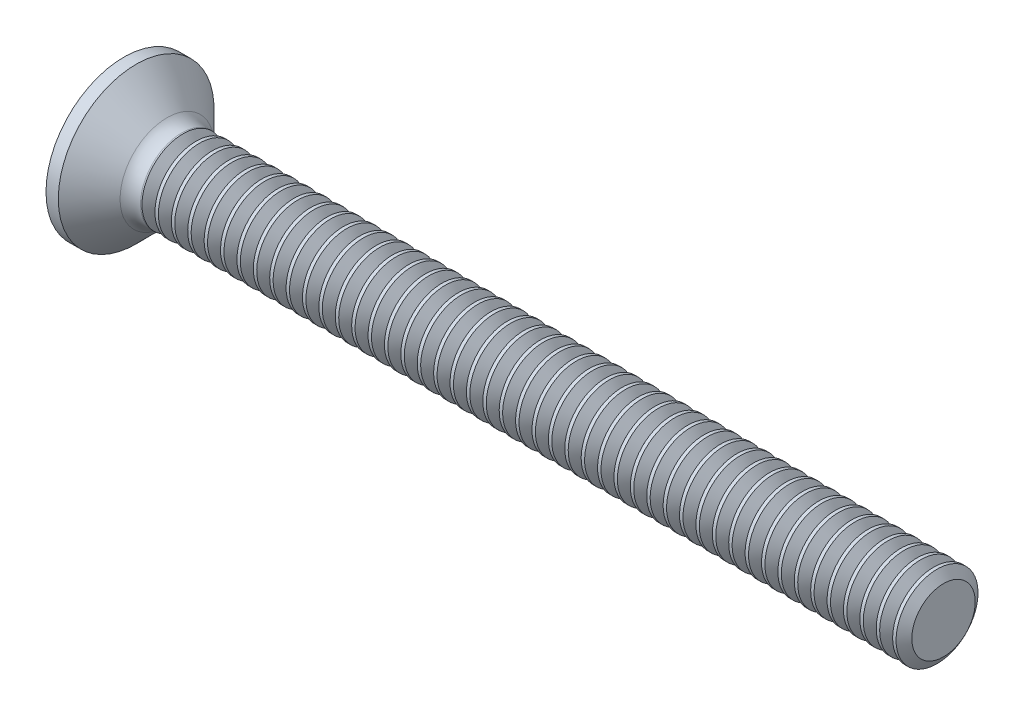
SolidWorks part; units mm, degrees
revolve "Base-Revolve" add sketch "BodySke" angle 360 about L5
sketch "BodySke" plane through (0, 0, 0) normal (0, 0, 1) x (1, 0, 0)
  line L0 (0, 0) -> (0, 1.9)
  line L1 (0, 1.9) -> (0.3, 1.9)
  line L2 (1.2, 1) -> (20, 1)
  line L3 (20, 1) -> (20, 0)
  line L4 (20, 0) -> (0, 0)
  line L5 (-6.35, 0) -> (82.55, 0) construction
  line L6 (1.2, -1) -> (20, -1) construction
  line L7 (0.3, -1.9) -> (1.2, -1) construction
  line L8 (0.3, 1.9) -> (1.2, 1)
  line L9 (0, -1.9) -> (0.3, -1.9) construction
  line L10 (1.6, 2.5875) -> (1.6, -6.9375) construction
  line L11 (0, 6.35) -> (0, -3.175) construction
ref_plane "Plane1" through (0, 0, 0) normal (0, 0, 1) x (1, 0, 0)
ref_plane "Plane2" through (0, 0, 0) normal (0, 1, 0) x (1, 0, 0)
ref_plane "Plane3" through (0, 0, 0) normal (1, 0, 0) x (0, 0, -1)
fillet "Fillet1" radius 0.5 1 edges at (1.2, 0, 1)
sketch "Sketch3" plane through (0, 0, 0) normal (-1, 0, 0) x (0, 0, 1)
  line L0 (-0.24, 0.95) -> (0.24, 0.95)
  line L1 (0.24, 0.95) -> (0.24, -0.95)
  line L2 (0.24, -0.95) -> (-0.24, -0.95)
  line L3 (-0.24, -0.95) -> (-0.24, 0.95)
ref_plane "Plane4" through (1.2, 0, 0) normal (-1, 0, 0) x (0, 0, 1)
sketch "Sketch4" plane through (1.2, 0, 0) normal (-1, 0, 0) x (0, 0, 1)
  line L0 (-0.24, 0.3517) -> (0.24, 0.3517)
  line L3 (0.24, 0.3517) -> (0.24, -0.3517)
  line L4 (0.24, -0.3517) -> (-0.24, -0.3517)
  line L5 (-0.24, -0.3517) -> (-0.24, 0.3517)
loft "Recess" cut profiles "Sketch3", "Sketch4"
pattern_circular "RecPat" count 2 every 90 about axis through (0, 0, 0) along (1, 0, 0) of "Recess"
sketch "RecCorSke" plane through (0, 0, 0) normal (0, 0, 1) x (1, 0, 0)
  line L0 (-3.175, 0) -> (15.875, 0) construction
  line L2 (0, 0) -> (0, 0.4394)
  line L3 (0, 0.4394) -> (1.2, 0.3555)
  line L4 (1.2, 0.3555) -> (1.3155, 0)
  line L5 (1.3155, 0) -> (0, 0)
revolve "RecessCore" cut sketch "RecCorSke" angle 360 about L0
sketch "ThdSchSke" plane through (0, 0, 0) normal (0, 0, 1) x (1, 0, 0)
  line L0 (1.6, -0.774) -> (1.4418, -1)
  line L1 (1.6, -0.774) -> (1.7582, -1)
  line L2 (1.7582, -1) -> (1.7582, -1.25)
  line L3 (-3.175, 0) -> (5.1513, 0) construction
  line L5 (1.7582, -1.25) -> (1.4418, -1.25)
  line L6 (1.4418, -1.25) -> (1.4418, -1)
  line L7 (0, 1.9) -> (0, -1.9) construction
revolve "ThreadSchematic" cut sketch "ThdSchSke" angle 360 about L3
pattern_linear "ThdSchPat" count 47 spacing 0.4 along (1, 0, 0) of "ThreadSchematic"
equation "\"D1@Sketch3\" = \"Cross_dia@Sketch3\" / 2"
equation "\"D2@Sketch3\" = \"Cross_width@Sketch3\" / 2"
equation "\"Depth@RecCorSke\" = \"Cross_depth@Plane4\""
equation "\"D1@Sketch4\" = \"Cross_width@Sketch3\""
equation "\"D2@Sketch4\" = \"Cross_dia@Sketch3\" - 2.0 * \"Cross_depth@Plane4\" * tan(26.5  * 0.017453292)"
equation "\"D3@Sketch4\" = \"D1@Sketch4\" / 2"
equation "\"D4@Sketch4\" = \"D2@Sketch4\" / 2"
equation "\"Thread_length@ThreadCosmetic\" = ((sgn( (\"Length@BodySke\" - \"Advance@BodySke\" * 1.0 - \"Head_ht@BodySke\" ) - \"Thread_nom@BodySke\" )-1)*( (\"Length@BodySke\" - \"Advance@BodySke\" * 1.0 - \"Head_ht@BodySke\" "
equation "\"Thread_minor@ThdSchSke\" = \"Thread_minor@ThreadCosmetic\""
equation "\"Diameter@ThdSchSke\" = \"Diameter@BodySke\""
equation "\"Overcut@ThdSchSke\" = \"Diameter@BodySke\" * 1.25"
equation "\"Start@ThdSchSke\" = 0.000001 + \"Length@BodySke\" - \"Thread_length@ThreadCosmetic\"  '---Countersunk---"
equation "\"Num_threads@ThdSchPat\" = int( \"Thread_length@ThreadCosmetic\" / \"Advance@BodySke\" + 0.999 )  + 1"
equation "\"Advance@ThdSchPat\" = \"Thread_length@ThreadCosmetic\" /  (\"Num_threads@ThdSchPat\" - 1) 'relax it"
